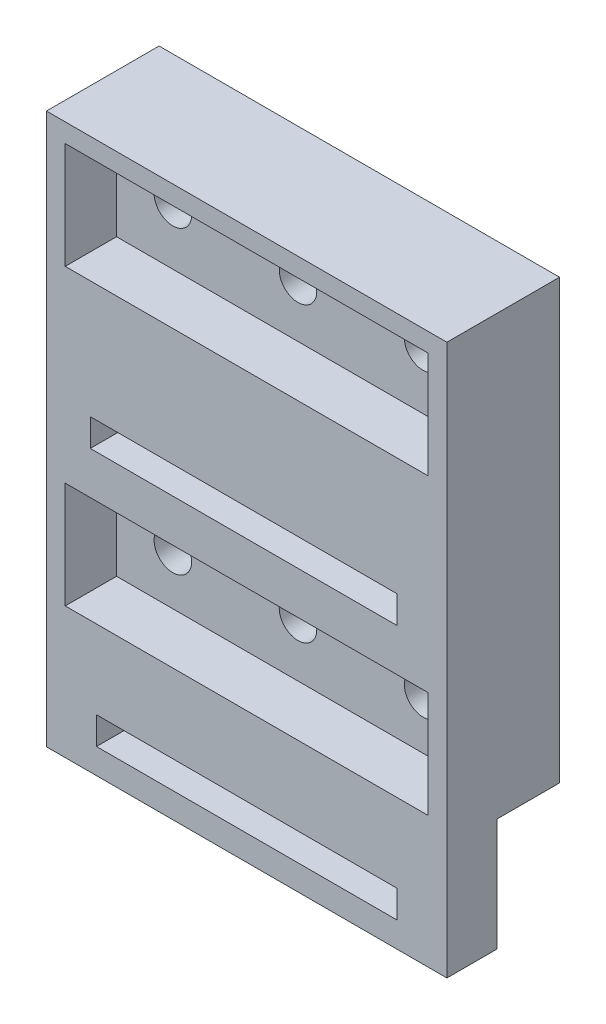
SolidWorks part; units mm, degrees
ref_plane "Front Plane" through (0, 0, 0) normal (0, 0, 1) x (1, 0, 0)
ref_plane "Top Plane" through (0, 0, 0) normal (0, 1, 0) x (1, 0, 0)
ref_plane "Right Plane" through (0, 0, 0) normal (1, 0, 0) x (0, 0, -1)
sketch "Sketch4" plane through (0, 0, 0) normal (0, 0, 1) x (1, 0, 0)
  line L0 (-16, 17.5) -> (16, -17.5) construction
  line L1 (-16, 17.5) -> (16, 17.5)
  line L2 (-16, 17.5) -> (-16, -17.5)
  line L3 (-16, -17.5) -> (16, -17.5)
  line L4 (16, 17.5) -> (16, -17.5)
  line L5 (16, 17.5) -> (-16, -17.5) construction
  point P4 (0, 0)
  dimension "D1" = 32
  dimension "D2" = 35
extrude "Boss-Extrude1" add sketch "Sketch4" along normal blind 9
shell "Shell1" thickness 1.5
sketch "Sketch5" plane through (0, 0, 4.9) normal (0, 0, 1) x (1, 0, 0)
  line L0 (-14.5, 15) -> (-14.5, -15) construction
  line L1 (-14.5, -15) -> (14.5, -15) construction
  line L2 (14.5, -15) -> (14.5, 15) construction
  line L3 (14.5, 15) -> (-14.5, 15) construction
  line L4 (-14.5, 15) -> (14.5, -15) construction
  line L5 (0, 18.6176) -> (0, -20.2425) construction
  line L6 (12.1043, 0) -> (-43.3409, 0) construction
  circle A0 centre (-10, -12) radius 1.5
  circle A1 centre (10, -12) radius 1.5
  circle A2 centre (0, 11.7) radius 1.5
  circle A3 centre (0, -11.7) radius 1.5
  circle A4 centre (-10, 12) radius 1.5
  circle A5 centre (10, 12) radius 1.5
  point P4 (0, 0)
  dimension "D7" = 3
  dimension "D1" = 29
  dimension "D2" = 30
  dimension "D3" = 20
  dimension "D4" = 3
  dimension "D5" = 10
  dimension "D6" = 23.7
extrude "Cut-Extrude2" cut sketch "Sketch5" against normal blind 9
sketch "Sketch12" plane through (0, 0, 9) normal (0, 0, 1) x (1, 0, 0)
  line L0 (14.5, 0) -> (-14.5, 0)
  line L1 (14.5, -16) -> (14.5, 16) construction
  line L2 (-14.5, 16) -> (-14.5, -16) construction
rib "Rib6" sketch "Sketch12" sketch "Sketch12" thickness 15 parameters "D1"=15
sketch "Sketch13" plane through (0, 0, 0) normal (0, 0, -1) x (-1, 0, 0)
  line L1 (14, -7) -> (-14, -7)
  line L2 (14, -7) -> (14, 1)
  line L3 (14, 1) -> (-14, 1)
  line L4 (-14, -7) -> (-14, 1)
  line L6 (16, 17.5) -> (16, -17.5) construction
  line L7 (-16, -17.5) -> (-16, 17.5) construction
  line L8 (14, -3) -> (-14, -3) construction
  line L10 (-16, 17.5) -> (16, 17.5) construction
  dimension "D1" = 8
  dimension "D2" = 20.5
  dimension "D3" = 2
  dimension "D4" = 2
extrude "Cut-Extrude3" cut sketch "Sketch13" against normal blind 5
sketch "Sketch15" plane through (0, 0, 5) normal (0, 0, -1) x (-1, 0, 0)
  line L1 (12.5, -1.9) -> (-12, -1.9)
  line L2 (12.5, -1.9) -> (12.5, -4.1)
  line L3 (12.5, -4.1) -> (-12, -4.1)
  line L4 (-12, -1.9) -> (-12, -4.1)
  line L6 (14.5, -7) -> (14.5, 1) construction
  line L7 (-14, 1) -> (-14, -7) construction
  dimension "D1" = 2.2
  dimension "D2" = 4.1
  dimension "D3" = 2
  dimension "D4" = 2
extrude "Cut-Extrude4" cut sketch "Sketch15" against normal blind 10
sketch "Sketch16" plane through (0, -17.5, 0) normal (0, -1, 0) x (1, 0, 0)
  line L0 (-16, 9) -> (-16, 0) construction
  line L1 (16, 9) -> (-16, 9)
  line L2 (16, 9) -> (16, 5)
  line L3 (16, 5) -> (-16, 5)
  line L4 (-16, 9) -> (-16, 5)
  dimension "D1" = 4
extrude "Boss-Extrude2" add sketch "Sketch16" along normal blind 9
sketch "Sketch17" plane through (0, 0, 9) normal (0, 0, 1) x (1, 0, 0)
  line L0 (-12.5, -4.1) -> (12, -4.1) construction
  line L1 (12, -24.48) -> (-12, -24.48)
  line L2 (12, -24.48) -> (12, -22.28)
  line L3 (12, -22.28) -> (-12, -22.28)
  line L4 (-12, -24.48) -> (-12, -22.28)
  line L6 (16, -26.5) -> (16, 17.5) construction
  line L7 (-16, 17.5) -> (-16, -26.5) construction
  dimension "D1" = 18.18
  dimension "D2" = 4
  dimension "D3" = 2.2
  dimension "44" = 4
extrude "Cut-Extrude5" cut sketch "Sketch17" against normal blind 10
